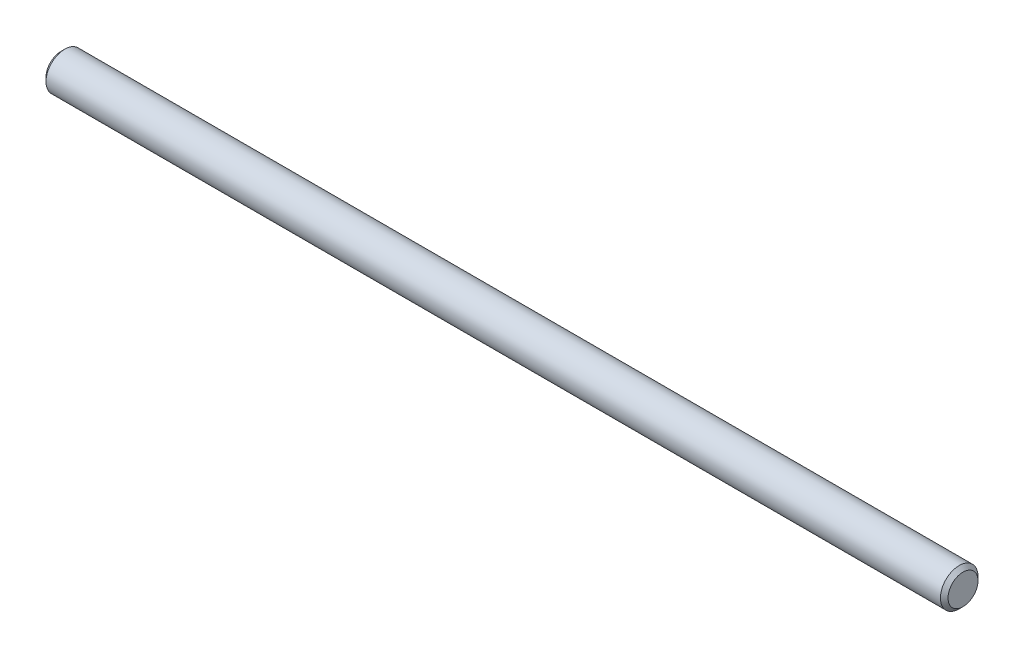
SolidWorks part; units mm, degrees
ref_plane "Front Plane" through (0, 0, 0) normal (0, 0, 1) x (1, 0, 0)
ref_plane "Top Plane" through (0, 0, 0) normal (0, 1, 0) x (1, 0, 0)
ref_plane "Right Plane" through (0, 0, 0) normal (1, 0, 0) x (0, 0, -1)
sketch "Sketch1" plane through (0, 0, 0) normal (1, 0, 0) x (0, 0, -1)
  circle A0 centre (0, 0) radius 4
  dimension "D1" = 8
extrude "Boss-Extrude1" add sketch "Sketch1" along normal mid plane 192
chamfer "Chamfer1" distance 0.81 angle 45 2 edges at (96, 0, -4) (-96, 0, -4)
